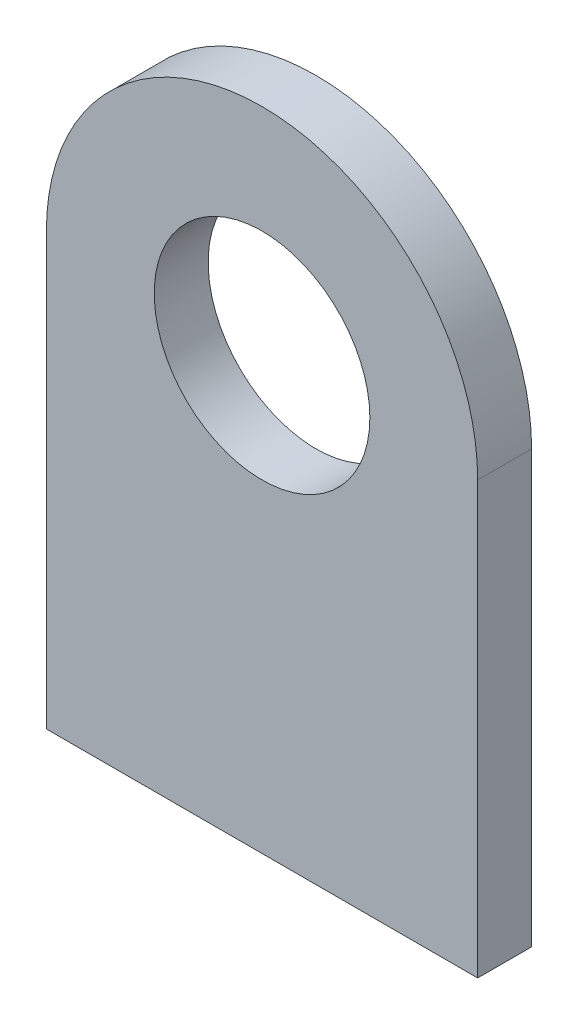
SolidWorks part; units mm, degrees
ref_plane "Front Plane" through (0, 0, 0) normal (0, 0, 1) x (1, 0, 0)
ref_plane "Top Plane" through (0, 0, 0) normal (0, 1, 0) x (1, 0, 0)
ref_plane "Right Plane" through (0, 0, 0) normal (1, 0, 0) x (0, 0, -1)
sketch "Sketch1" plane through (0, 0, 0) normal (0, 0, 1) x (1, 0, 0)
  line L0 (0, 40) -> (0, 0)
  line L1 (0, 0) -> (-40, 0)
  line L2 (-40, 0) -> (-40, 40)
  arc A0 (-40, 40) -> (0, 40) centre (-20, 40) cw
  dimension "D1" = 40
  dimension "D2" = 40
extrude "Extrude1" add sketch "Sketch1" along normal blind 5
sketch "Sketch2" plane through (0, 0, 5) normal (0, 0, 1) x (1, 0, 0)
  circle A0 centre (-20, 40) radius 10
  dimension "D1" = 20
extrude "Cut-Extrude1" cut sketch "Sketch2" against normal through all
